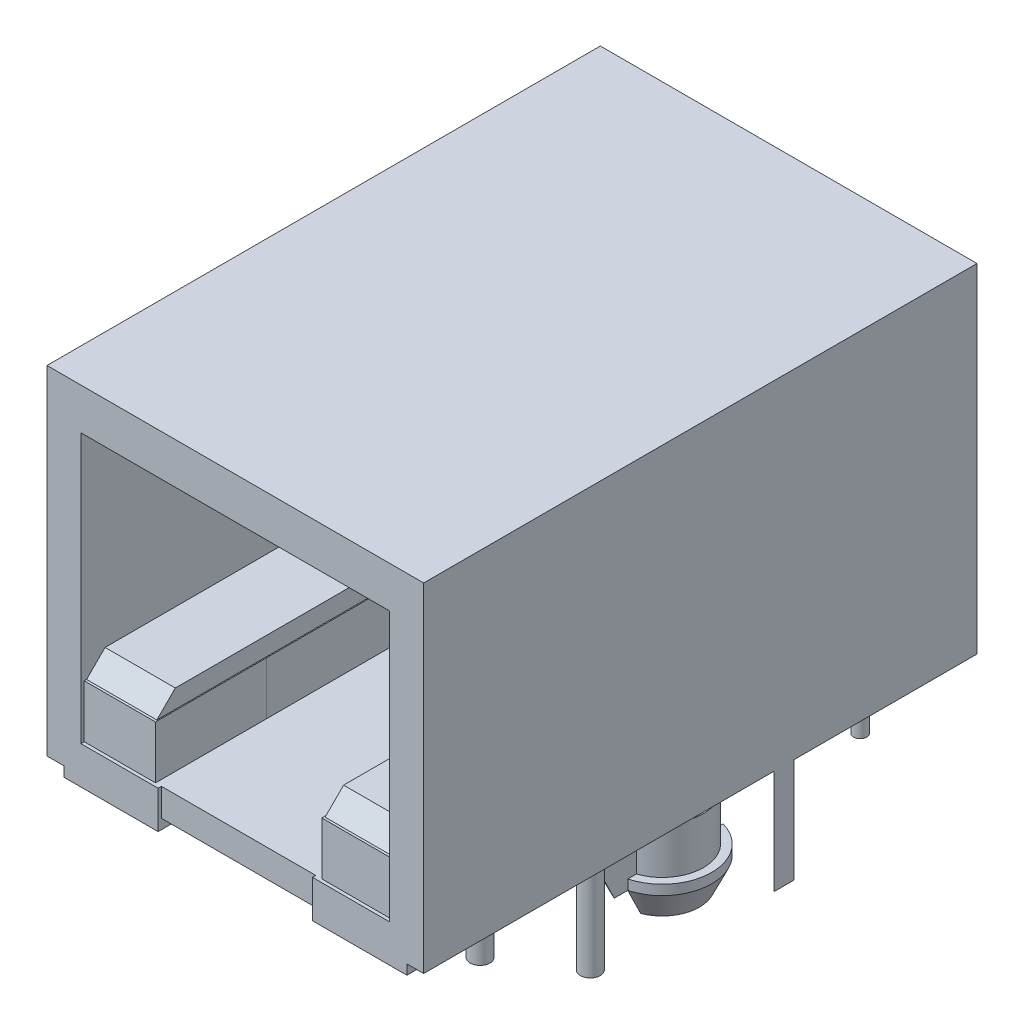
SolidWorks part; units mm, degrees
ref_plane "Front" through (0, 0, 0) normal (0, 0, 1) x (1, 0, 0)
ref_plane "Top" through (0, 0, 0) normal (0, 1, 0) x (1, 0, 0)
ref_plane "Right" through (0, 0, 0) normal (1, 0, 0) x (0, 0, -1)
sketch "Sketch1" plane through (0, 0, 0) normal (1, 0, 0) x (0, 0, -1)
  line L1 (0, 0) -> (-21.3, 0)
  line L2 (0, 0) -> (0, 13.02)
  line L3 (0, 13.02) -> (-21.3, 13.02)
  line L4 (-21.3, 0) -> (-21.3, 13.02)
  dimension "D1" = 21.3
  dimension "D2" = 13.02
extrude "Extrude1" add sketch "Sketch1" along normal mid plane 14.5
sketch "Sketch2" plane through (0, 0, 21.3) normal (0, 0, 1) x (1, 0, 0)
  line L0 (7.25, 0) -> (-7.25, 0) construction
  line L1 (-5.9436, 11.43) -> (5.9436, 11.43)
  line L2 (-5.9436, 11.43) -> (-5.9436, 1.0668)
  line L3 (-5.9436, 1.0668) -> (-2.9718, 1.0668)
  line L4 (5.9436, 11.43) -> (5.9436, 1.0668)
  line L5 (2.9718, 1.0668) -> (5.9436, 1.0668)
  line L7 (-2.9718, 1.0668) -> (-2.9718, 0)
  line L8 (-2.9718, 0) -> (2.9718, 0)
  line L9 (2.9718, 1.0668) -> (2.9718, 0)
  dimension "D1" = 11.8872
  dimension "D2" = 10.3632
  dimension "D3" = 1.0668
  dimension "D4" = 5.9436
  dimension "D5" = 5.9436
  dimension "D6" = 2.9718
extrude "Cut-Extrude1" cut sketch "Sketch2" against normal blind 0.127
sketch "Sketch3" plane through (0, 0, 21.173) normal (0, 0, 1) x (1, 0, 0)
  line L0 (-5.9436, 3.0988) -> (-3.2004, 3.0988)
  line L1 (-3.2004, 3.0988) -> (-3.2004, 1.0668)
  line L2 (3.2004, 1.0668) -> (3.2004, 3.0988)
  line L3 (3.2004, 3.0988) -> (5.9436, 3.0988)
  line L4 (-5.9436, 11.43) -> (-5.9436, 1.0668)
  line L5 (-5.9436, 1.0668) -> (-2.9718, 1.0668)
  line L6 (5.9436, 1.0668) -> (5.9436, 11.43)
  line L7 (5.9436, 11.43) -> (-5.9436, 11.43)
  line L8 (-5.9436, 11.43) -> (-5.9436, 3.0988)
  line L9 (-3.2004, 1.0668) -> (3.2004, 1.0668)
  line L10 (5.9436, 3.0988) -> (5.9436, 11.43)
  line L11 (5.9436, 11.43) -> (-5.9436, 11.43)
  line L20 (-2.9718, 1.0668) -> (-2.9718, 0)
  line L22 (-2.9718, 0) -> (2.9718, 0)
  line L24 (2.9718, 0) -> (2.9718, 1.0668)
  line L26 (2.9718, 1.0668) -> (5.9436, 1.0668)
  dimension "D3" = 6.4008
  dimension "D4" = 3.2004
  dimension "D1" = 0
extrude "Cut-Extrude2" cut sketch "Sketch3" against normal blind 11.303
sketch "Sketch4" plane through (0, 0, 0) normal (1, 0, 0) x (0, 0, -1)
  line L0 (-9.87, 11.43) -> (-21.3, 11.43) construction
  line L1 (-17.5928, 11.43) -> (-18.76, 11.43)
  line L2 (-9.87, 3.0988) -> (-9.87, 11.43) construction
  line L3 (-9.87, 8.128) -> (-9.87, 8.5615)
  line L4 (-18.76, 11.43) -> (-9.87, 8.128)
  line L5 (-17.5928, 11.43) -> (-9.87, 8.5615)
  dimension "D1" = 3.302
  dimension "D2" = 2.54
  dimension "D3" = 0.4064
extrude "Extrude2" add sketch "Sketch4" along normal mid plane 7.5997
sketch "Sketch5" plane through (0, 0, 21.3) normal (0, 0, 1) x (1, 0, 0)
  line L0 (5.9436, 11.43) -> (-5.9436, 11.43) construction
  line L1 (-3.3528, 11.43) -> (-2.9058, 11.43)
  line L2 (-3.3528, 11.43) -> (-3.3528, 8.128)
  line L3 (-3.3528, 8.128) -> (-2.9058, 8.128)
  line L4 (-2.9058, 11.43) -> (-2.9058, 8.128)
  line L5 (3.7998, 8.128) -> (-3.7998, 8.128) construction
  line L6 (-3.7998, 11.43) -> (-3.7998, 8.128) construction
  line L8 (-2.4587, 11.43) -> (-2.0117, 11.43)
  line L9 (-2.4587, 11.43) -> (-2.4587, 8.128)
  line L10 (-2.4587, 8.128) -> (-2.0117, 8.128)
  line L11 (-2.0117, 11.43) -> (-2.0117, 8.128)
  line L12 (-1.5646, 11.43) -> (-1.1176, 11.43)
  line L13 (-1.5646, 11.43) -> (-1.5646, 8.128)
  line L14 (-1.5646, 8.128) -> (-1.1176, 8.128)
  line L15 (-1.1176, 11.43) -> (-1.1176, 8.128)
  line L16 (-0.6706, 11.43) -> (-0.2235, 11.43)
  line L17 (-0.6706, 11.43) -> (-0.6706, 8.128)
  line L18 (-0.6706, 8.128) -> (-0.2235, 8.128)
  line L19 (-0.2235, 11.43) -> (-0.2235, 8.128)
  line L20 (0.2235, 11.43) -> (0.6706, 11.43)
  line L21 (0.2235, 11.43) -> (0.2235, 8.128)
  line L22 (0.2235, 8.128) -> (0.6706, 8.128)
  line L23 (0.6706, 11.43) -> (0.6706, 8.128)
  line L24 (1.1176, 11.43) -> (1.5646, 11.43)
  line L25 (1.1176, 11.43) -> (1.1176, 8.128)
  line L26 (1.1176, 8.128) -> (1.5646, 8.128)
  line L27 (1.5646, 11.43) -> (1.5646, 8.128)
  line L28 (2.0117, 11.43) -> (2.4587, 11.43)
  line L29 (2.0117, 11.43) -> (2.0117, 8.128)
  line L30 (2.0117, 8.128) -> (2.4587, 8.128)
  line L31 (2.4587, 11.43) -> (2.4587, 8.128)
  line L32 (2.9058, 11.43) -> (3.3528, 11.43)
  line L33 (2.9058, 11.43) -> (2.9058, 8.128)
  line L34 (2.9058, 8.128) -> (3.3528, 8.128)
  line L35 (3.3528, 11.43) -> (3.3528, 8.128)
  dimension "D1" = 0.447
  dimension "D2" = 0.447
  dimension "D3" = 0.447
  dimension "D4" = 0.447
  dimension "D5" = 0.447
  dimension "D6" = 0.447
  dimension "D7" = 0.447
  dimension "D8" = 0.447
  dimension "D9" = 0.447
  dimension "D10" = 0.447
  dimension "D11" = 0.447
  dimension "D12" = 0.447
  dimension "D13" = 0.447
  dimension "D14" = 0.447
  dimension "D15" = 0.447
  dimension "D16" = 0.447
extrude "Cut-Extrude3" cut sketch "Sketch5" against normal up to surface (11.43 mm away)
sketch "Sketch6" plane through (-5.9436, 0, 0) normal (1, 0, 0) x (0, 0, -1)
  line L0 (-9.87, 3.0988) -> (-21.173, 3.0988) construction
  line L1 (-9.87, 3.0988) -> (-21.082, 3.0988)
  line L2 (-21.082, 3.0988) -> (-20.3708, 3.81)
  line L3 (-20.3708, 3.81) -> (-12.446, 3.81)
  line L4 (-12.446, 3.81) -> (-12.446, 4.826)
  line L5 (-12.446, 4.826) -> (-9.87, 4.826)
  line L6 (-9.87, 3.0988) -> (-9.87, 11.43) construction
  line L7 (-9.87, 4.826) -> (-9.87, 3.0988)
  dimension "D1" = 3.81
  dimension "D2" = 12.446
  dimension "D3" = 4.826
  dimension "D4" = 21.082
  dimension "D5" = 45
extrude "Extrude3" add sketch "Sketch6" along normal blind 2.7051
mirror "Mirror1" about plane through (0, 0, 0) normal (1, 0, 0) of "Extrude3"
sketch "Sketch8" plane through (-3.2004, 0, 0) normal (1, 0, 0) x (0, 0, -1)
  line L0 (-16.891, 3.0988) -> (-16.891, 1.0668)
  line L1 (-21.082, 3.0988) -> (-9.87, 3.0988) construction
  line L2 (-9.87, 1.0668) -> (-21.173, 1.0668) construction
  dimension "D1" = 16.891
sketch "Sketch9" plane through (3.2004, 0, 0) normal (-1, 0, 0) x (0, 0, 1)
  line L0 (16.891, 3.0988) -> (16.891, 1.0668) construction
  line L1 (16.891, 3.0988) -> (16.891, 1.0668)
sketch "Sketch11" plane through (0, 3.0988, 0) normal (0, 1, 0) x (-1, 0, 0)
  line L0 (3.2385, 16.891) -> (3.2004, 16.891)
  line L1 (3.2385, 12.446) -> (3.2385, 20.3708) construction
  line L2 (3.2004, 16.891) -> (3.2004, 21.173) construction
  dimension "D1" = 16.891
sketch "Sketch12" plane through (0, 3.0988, 0) normal (0, 1, 0) x (-1, 0, 0)
  line L0 (-3.2385, 16.891) -> (-3.2004, 16.891)
  line L1 (-3.2385, 12.446) -> (-3.2385, 20.3708) construction
  line L2 (-3.2004, 16.891) -> (-3.2004, 21.173) construction
  dimension "D1" = 16.891
sketch "Sketch14" plane through (0, 0, 0) normal (0, -1, 0) x (1, 0, 0)
  line L1 (-6.604, 21.3) -> (-2.9718, 21.3)
  line L3 (-6.604, 18.252) -> (6.604, 18.252)
  line L5 (-2.9718, 21.173) -> (-2.9718, 21.3) construction
  line L6 (-6.604, 21.3) -> (-6.604, 18.252)
  line L7 (2.9718, 21.3) -> (2.9718, 20.792)
  line L8 (2.9718, 20.792) -> (-2.9718, 20.792)
  line L9 (-2.9718, 21.3) -> (-2.9718, 20.792)
  line L10 (2.9718, 21.3) -> (6.604, 21.3)
  line L11 (6.604, 21.3) -> (6.604, 18.252)
  dimension "D1" = 0.508
  dimension "D2" = 3.048
  dimension "D3" = 13.208
  dimension "D4" = 6.604
extrude "Extrude4" add sketch "Sketch14" along normal blind 0.381
sketch "Sketch15" plane through (0, 0, 0) normal (0, -1, 0) x (1, 0, 0)
  line L0 (6.927, 21.3) -> (6.927, 0)
  line L1 (7.25, 21.3) -> (6.604, 21.3) construction
  line L2 (7.25, 0) -> (-7.25, 0) construction
sketch "Sketch16" plane through (0, 0, 0) normal (0, -1, 0) x (1, 0, 0)
  line L0 (-6.927, 21.3) -> (-6.927, 0)
  line L1 (-6.604, 21.3) -> (-7.25, 21.3) construction
  line L2 (6.927, 0) -> (-7.25, 0) construction
sketch "Sketch13" plane through (0, 0, 0) normal (0, -1, 0) x (1, 0, 0)
  line L0 (7.25, 21.3) -> (2.9718, 21.3) construction
  circle A0 centre (-5.715, 10.5812) radius 1.5875
  circle A1 centre (5.715, 10.5812) radius 1.5875
  dimension "D1" = 3.175
  dimension "D2" = 10.7188
  dimension "D3" = 11.43
  dimension "D4" = 5.715
extrude "Extrude5" add sketch "Sketch13" along normal blind 1.8034
sketch "Sketch17" plane through (0, -1.8034, 0) normal (0, -1, 0) x (1, 0, 0)
  circle A0 centre (5.715, 10.5812) radius 1.905
  circle A1 centre (-5.715, 10.5812) radius 1.905
  dimension "D1" = 3.81
extrude "Extrude6" add sketch "Sketch17" along normal blind 1.397
chamfer "Chamfer1" distance 1.016 angle 25 2 edges at (-5.715, -3.2004, 8.6762) (5.715, -3.2004, 8.6762)
sketch "Sketch19" plane through (0, -3.2004, 0) normal (0, -1, 0) x (1, 0, 0)
  line L1 (6.223, 13.1212) -> (5.207, 13.1212)
  line L2 (6.223, 13.1212) -> (6.223, 8.0412)
  line L3 (6.223, 8.0412) -> (5.207, 8.0412)
  line L4 (5.207, 13.1212) -> (5.207, 8.0412)
  line L5 (-5.207, 13.1212) -> (-6.223, 13.1212)
  line L6 (-5.207, 13.1212) -> (-5.207, 8.0412)
  line L7 (-5.207, 8.0412) -> (-6.223, 8.0412)
  line L8 (-6.223, 13.1212) -> (-6.223, 8.0412)
  circle A0 centre (5.715, 10.5812) radius 1.4312 construction
  circle A1 centre (-5.715, 10.5812) radius 1.4312 construction
  dimension "D1" = 1.016
  dimension "D2" = 0.508
  dimension "D3" = 1.016
  dimension "D4" = 0.508
  dimension "D5" = 5.08
  dimension "D6" = 2.54
extrude "Cut-Extrude4" cut sketch "Sketch19" against normal up to surface (3.2004 mm away)
sketch "Sketch20" plane through (0, 0, 0) normal (0, -1, 0) x (1, 0, 0)
  line L0 (7.25, 0) -> (7.25, 21.3) construction
  line L1 (7.25, 7.0474) -> (7.25, 7.8158)
  line L2 (-7.25, 0) -> (-7.25, 21.3) construction
  line L3 (-7.25, 7.0474) -> (-7.25, 7.8158)
  circle A0 centre (-3.7846, 13.9594) radius 0.381
  circle A1 centre (6.3246, 13.9594) radius 0.381
  circle A2 centre (3.7846, 15.6612) radius 0.381
  circle A3 centre (-6.3246, 15.6612) radius 0.381
  arc A4 (6.223, 8.7452) -> (6.223, 12.4172) centre (5.715, 10.5812) ccw construction
  arc A5 (7.25, 7.8158) -> (7.25, 7.0474) centre (7.62, 7.4316) ccw
  arc A6 (-7.25, 7.0474) -> (-7.25, 7.8158) centre (-7.62, 7.4316) ccw
  dimension "D1" = 0.762
  dimension "D8" = 1.0668
  dimension "D2" = 7.5692
  dimension "D3" = 12.6492
  dimension "D4" = 5.08
  dimension "D5" = 3.3782
  dimension "D6" = 3.7846
  dimension "D7" = 6.3246
  dimension "D9" = 15.24
  dimension "D10" = 7.62
  dimension "D11" = 3.1496
extrude "Extrude7" add sketch "Sketch20" along normal blind 4.0132
sketch "Sketch21" plane through (0, 0, 0) normal (0, -1, 0) x (1, 0, 0)
  circle A0 centre (3.175, 4.2312) radius 0.254
  circle A1 centre (0.635, 4.2312) radius 0.254
  circle A2 centre (-1.905, 4.2312) radius 0.254
  circle A3 centre (-4.445, 4.2312) radius 0.254
  circle A4 centre (-3.175, 1.6912) radius 0.254
  circle A5 centre (-0.635, 1.6912) radius 0.254
  circle A6 centre (1.905, 1.6912) radius 0.254
  circle A7 centre (4.445, 1.6912) radius 0.254
  arc A8 (6.223, 8.7452) -> (6.223, 12.4172) centre (5.715, 10.5812) ccw construction
  dimension "D1" = 0.508
  dimension "D2" = 6.35
  dimension "D3" = 8.89
  dimension "D4" = 1.27
  dimension "D5" = 0.635
  dimension "D6" = 3.81
  dimension "D7" = 8.89
  dimension "D8" = 6.35
  dimension "D9" = 1.905
  dimension "D10" = 3.175
  dimension "D11" = 4.445
extrude "Extrude8" add sketch "Sketch21" along normal blind 3.2004
